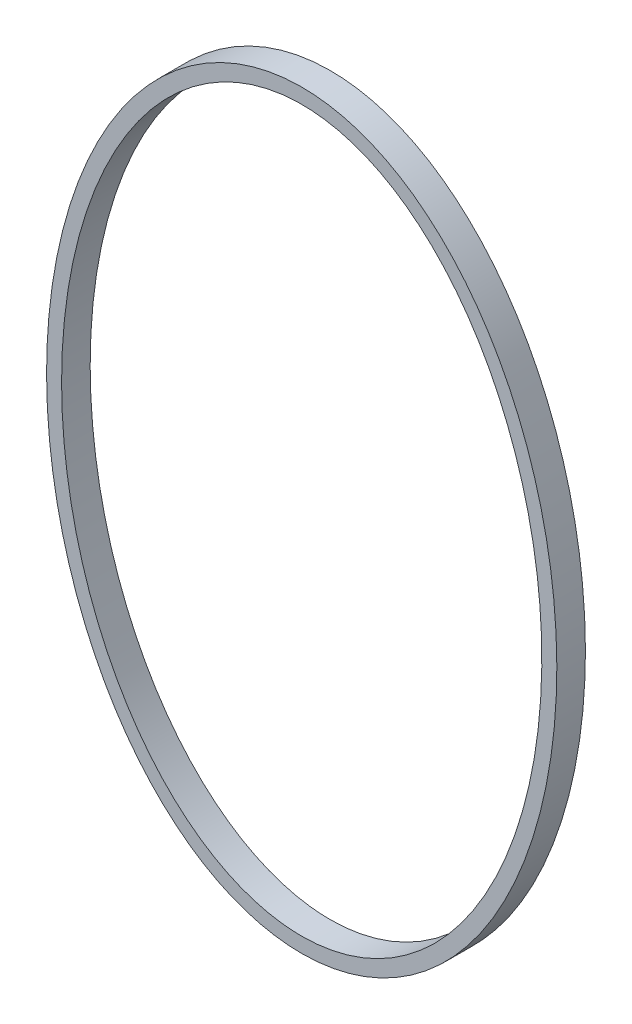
SolidWorks part; units mm, degrees
ref_plane "Front Plane" through (0, 0, 0) normal (0, 0, 1) x (1, 0, 0)
ref_plane "Top Plane" through (0, 0, 0) normal (0, 1, 0) x (1, 0, 0)
ref_plane "Right Plane" through (0, 0, 0) normal (1, 0, 0) x (0, 0, -1)
sketch "Sketch1" plane through (0, 0, 0) normal (0, 0, 1) x (1, 0, 0)
  ellipse E0 centre (0, 0) end of major axis (0, -60) minor radius 40 construction
  ellipse E1 centre (0, 0) end of major axis (0, -60) minor radius 40
  point P11 (0, -62.5)
  dimension "D1" = 2.5
extrude "3/16in cast clear acrylic" add sketch "Sketch1" against normal blind 4.7625
equation "\"D1@3/16in cast clear acrylic\" =  ( 3in / 16 ) "
